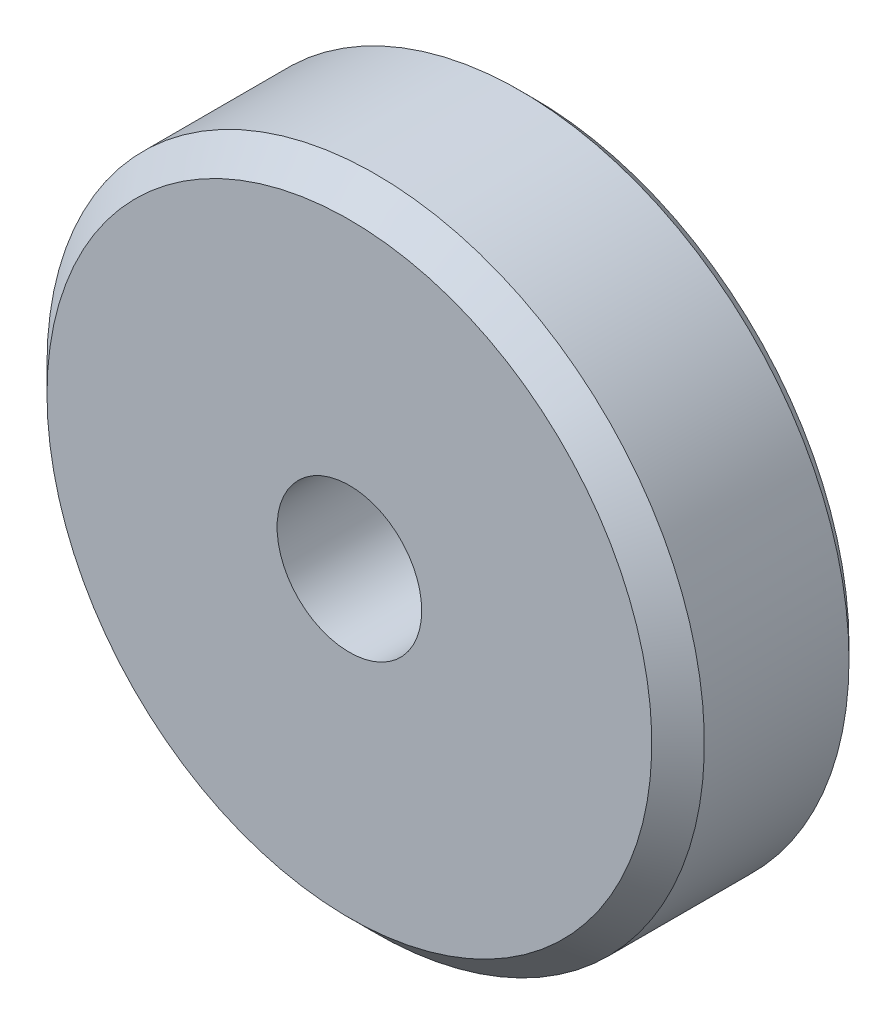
SolidWorks part; units mm, degrees
ref_plane "Plan1" through (0, 0, 0) normal (0, 0, 1) x (1, 0, 0)
ref_plane "Plan2" through (0, 0, 0) normal (0, 1, 0) x (1, 0, 0)
ref_plane "Plan3" through (0, 0, 0) normal (1, 0, 0) x (0, 0, -1)
sketch "Esquisse1" plane through (0, 0, 0) normal (0, 0, 1) x (1, 0, 0)
  circle A0 centre (0, 0) radius 12.5
  dimension "D1" = 25
extrude "BaseExtrusion" add sketch "Esquisse1" along normal blind 7
chamfer "Chanfrein1" distance 1 angle 45
sketch "Esquisse2" plane through (0, 0, 0) normal (0, 1, 0) x (1, 0, 0)
  line L0 (0, 0) -> (0, 1.7057) construction
  line L1 (0, -6) -> (0, 0) construction
  circle A0 centre (0, -0.65) radius 1.25
  dimension "D1" = 2.5
  dimension "D2" = 0.65
extrude "Bossage-Extrusion1" add sketch "Esquisse2" along normal mid plane 12.5
sketch "Esquisse3" plane through (0, 0, 7) normal (0, 0, 1) x (1, 0, 0)
  circle A0 centre (0, 0) radius 2.75
  dimension "D1" = 5.5
extrude "Enlèv. mat.-Extrusion1" cut sketch "Esquisse3" against normal through all
chamfer "Chanfrein2" distance 0.5 angle 45
